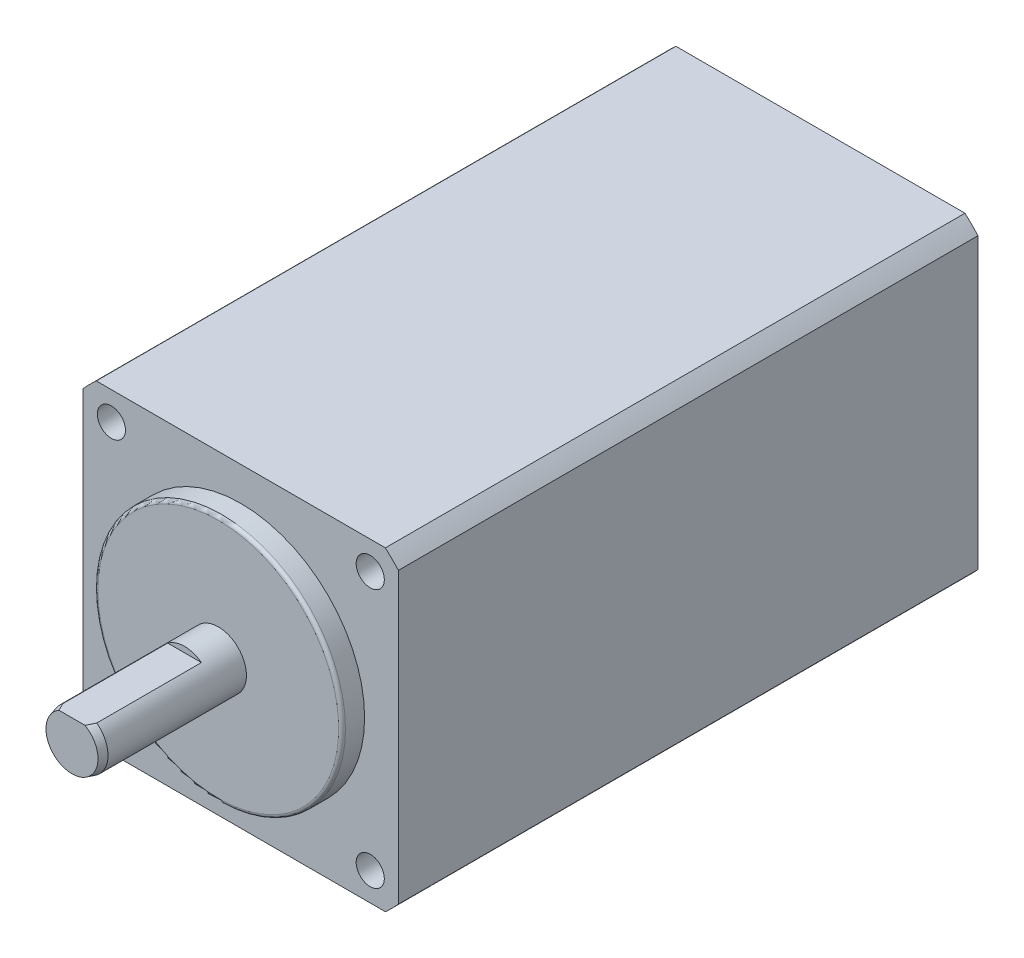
SolidWorks part; units mm, degrees
ref_plane "正面" through (0, 0, 0) normal (0, 0, 1) x (1, 0, 0)
ref_plane "平面" through (0, 0, 0) normal (0, 1, 0) x (1, 0, 0)
ref_plane "右側面" through (0, 0, 0) normal (1, 0, 0) x (0, 0, -1)
sketch "Sketch1" plane through (0, 0, 0) normal (0, 0, 1) x (1, 0, 0)
  circle A0 centre (0, 0) radius 2.5
  dimension "D1" = 5
extrude "Extrude1" add sketch "Sketch1" along normal blind 15
sketch "Sketch2" plane through (0, 0, 0) normal (0, 0, -1) x (-1, 0, 0)
  circle A0 centre (0, 0) radius 11
  dimension "D1" = 22
extrude "Extrude2" add sketch "Sketch2" against normal blind 2
sketch "Sketch3" plane through (0, 0, 0) normal (0, 0, -1) x (-1, 0, 0)
  line L1 (14, -14) -> (-14, -14)
  line L2 (14, -14) -> (14, 14)
  line L3 (14, 14) -> (-14, 14)
  line L4 (-14, -14) -> (-14, 14)
  line L5 (14, -14) -> (-14, 14) construction
  line L6 (14, 14) -> (-14, -14) construction
  circle A0 centre (0, 0) radius 19
  point P0 (0, 0)
  dimension "D3" = 38
  dimension "D1" = 28
  dimension "D2" = 28
extrude "Extrude3" add sketch "Sketch3" along normal blind 51.5 separate body contours L2 A0 L3 L4 L1 M1 | M1
sketch "Sketch4" plane through (0, -14, 0) normal (0, -1, 0) x (1, 0, 0)
  line L0 (-12.8452, -51.5) -> (12.8452, -51.5) construction
  line L1 (-7.6, -51.5) -> (7.6, -51.5)
  line L2 (-7.6, -51.5) -> (-7.6, -42)
  line L3 (-7.6, -42) -> (7.6, -42)
  line L4 (7.6, -51.5) -> (7.6, -42)
  dimension "D1" = 9.5
  dimension "D2" = 15.2
  dimension "D3" = 7.6
extrude "Extrude4" add sketch "Sketch4" along normal blind 5
sketch "Sketch5" plane through (0, 0, 15) normal (0, 0, 1) x (1, 0, 0)
  line L1 (-2.5379, 4.1995) -> (2.6225, 4.1995)
  line L2 (-2.5379, 4.1995) -> (-2.5379, 2)
  line L3 (-2.5379, 2) -> (2.6225, 2)
  line L4 (2.6225, 4.1995) -> (2.6225, 2)
  dimension "D1" = 2
extrude "Extrude5" cut sketch "Sketch5" against normal blind 10
chamfer "Chamfer1" distance 0.7 angle 15 1 edges at (0, -2.5, 15)
sketch "Sketch6" plane through (0, 0, 0) normal (0, 0, 1) x (1, 0, 0)
  line L1 (11.5, -11.5) -> (-11.5, -11.5) construction
  line L2 (11.5, -11.5) -> (11.5, 11.5) construction
  line L3 (11.5, 11.5) -> (-11.5, 11.5) construction
  line L4 (-11.5, -11.5) -> (-11.5, 11.5) construction
  line L5 (11.5, -11.5) -> (-11.5, 11.5) construction
  line L6 (11.5, 11.5) -> (-11.5, -11.5) construction
  circle A0 centre (-11.5, 11.5) radius 1.25
  circle A1 centre (11.5, 11.5) radius 1.25
  circle A2 centre (-11.5, -11.5) radius 1.25
  circle A3 centre (11.5, -11.5) radius 1.25
  point P0 (0, 0)
  dimension "D3" = 2.5
  dimension "D1" = 23
  dimension "D2" = 23
extrude "Extrude6" cut sketch "Sketch6" against normal blind 4.5
fillet "Fillet2" radius 0.3 1 edges at (-11, 0, 2)
sketch "Sketch7" plane through (0, 0, -51.5) normal (0, 0, -1) x (-1, 0, 0)
  line L0 (-1.5, 2) -> (1.5, 2)
  circle A0 centre (0, 0) radius 2.5
  dimension "D1" = 5
  dimension "D2" = 2
extrude "Extrude7" add sketch "Sketch7" along normal blind 10 contours L0 A0
chamfer "Chamfer2" distance 0.7 angle 15 1 edges at (0, -2.5, -61.5)
